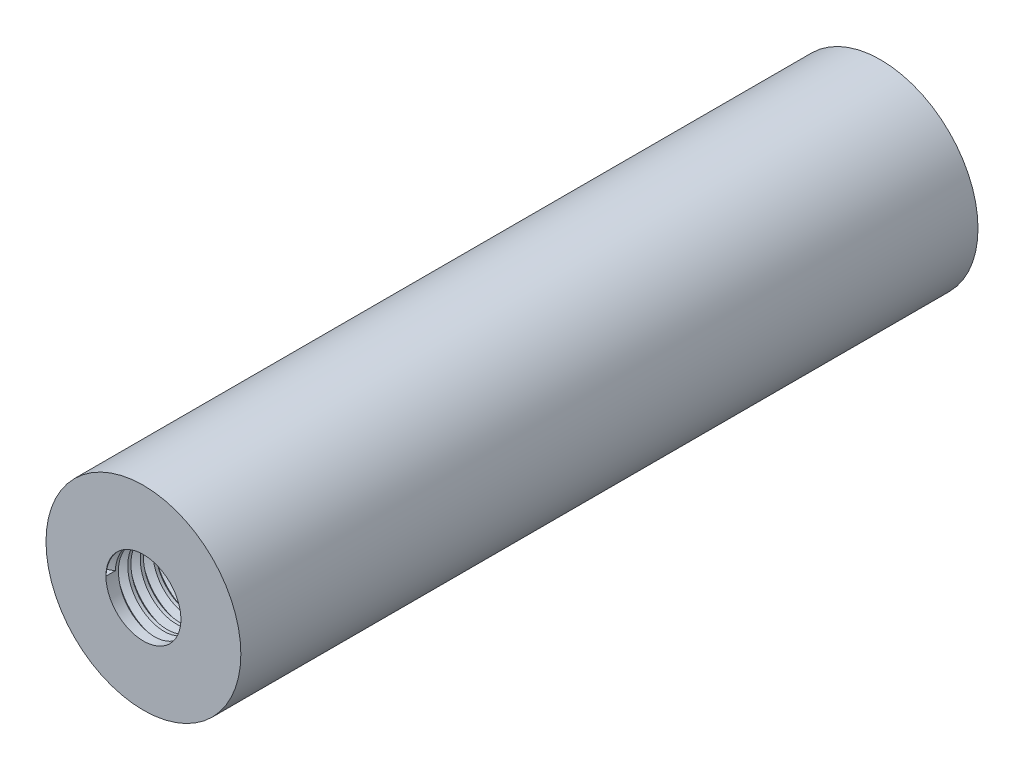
SolidWorks part; units mm, degrees
ref_plane "Front Plane" through (0, 0, 0) normal (0, 0, 1) x (1, 0, 0)
ref_plane "Top Plane" through (0, 0, 0) normal (0, 1, 0) x (1, 0, 0)
ref_plane "Right Plane" through (0, 0, 0) normal (1, 0, 0) x (0, 0, -1)
sketch "Sketch1" plane through (0, 0, 0) normal (0, 0, 1) x (1, 0, 0)
  circle A0 centre (0, 0) radius 7.7972
extrude "Boss-Extrude1" add sketch "Sketch1" along normal blind 59 contours A0
sketch "Sketch2" plane through (0, 0, 59) normal (0, 0, 1) x (1, 0, 0)
  circle A0 centre (0, 0) radius 3
  dimension "D1" = 6
extrude "Cut-Extrude1" cut sketch "Sketch2" against normal blind 7.5 contours A0
sketch "Sketch3" plane through (0, 0, 0) normal (0, 0, -1) x (-1, 0, 0)
  circle A0 centre (0, 0) radius 3
  dimension "D1" = 6
extrude "Cut-Extrude2" cut sketch "Sketch3" against normal blind 7.5
thread "Thread1" pitch 1 start angle 0, offset 0, length 0, pitch 1, diameter 6
ref_plane "Plane1" through (3, 0, 0) normal (0, -1, 0) x (1, 0, 0)
sketch "Thread Profile1" plane through (3, 0, 0) normal (0, -1, 0) x (1, 0, 0)
  line L0 (0, 0) -> (0, 1) construction
  line L1 (0, 0) -> (0.5413, 0.3125)
  line L2 (0.5413, 0.3125) -> (0.5413, 0.4375)
  line L3 (0.5413, 0.4375) -> (0, 0.75)
  line L4 (0.5413, 0.375) -> (0, 0.375) construction
  line L11 (0, 0) -> (0, 0.75)
  point P2 (0, 0)
  dimension "Pitch" = 1
  dimension "Profile_Angle" = 60
  dimension "Profile_Land" = 0.125
  dimension "Profile_Height" = 0.5413
thread "Thread2" pitch 1 start angle 0, offset 0, length 0, pitch 1, diameter 6
ref_plane "Plane2" through (-3, 0, 59) normal (0, -1, 0) x (-1, 0, 0)
sketch "Thread Profile2" plane through (-3, 0, 59) normal (0, -1, 0) x (-1, 0, 0)
  line L0 (0, 0) -> (0, 1) construction
  line L1 (0, 0) -> (0.5413, 0.3125)
  line L2 (0.5413, 0.3125) -> (0.5413, 0.4375)
  line L3 (0.5413, 0.4375) -> (0, 0.75)
  line L4 (0.5413, 0.375) -> (0, 0.375) construction
  line L11 (0, 0) -> (0, 0.75)
  point P2 (0, 0)
  dimension "Pitch" = 1
  dimension "Profile_Angle" = 60
  dimension "Profile_Land" = 0.125
  dimension "Profile_Height" = 0.5413
